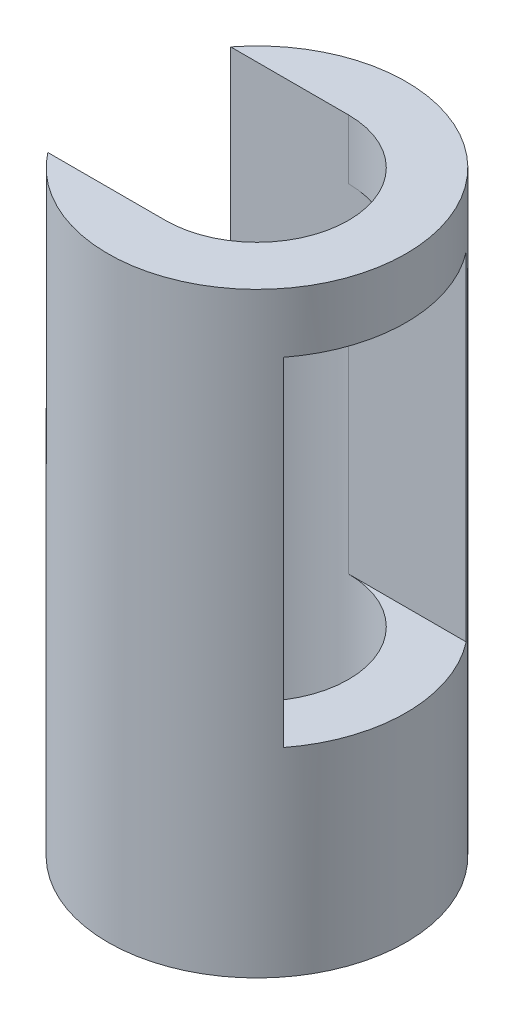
SolidWorks part; units mm, degrees
ref_plane "前视基准面" through (0, 0, 0) normal (0, 0, 1) x (1, 0, 0)
ref_plane "上视基准面" through (0, 0, 0) normal (0, 1, 0) x (1, 0, 0)
ref_plane "右视基准面" through (0, 0, 0) normal (1, 0, 0) x (0, 0, -1)
sketch "草图1" plane through (0, 0, 0) normal (0, 1, 0) x (1, 0, 0)
  circle A0 centre (0, 0) radius 4.6
  circle A1 centre (0, 0) radius 7.5
  dimension "D1" = 9.2
  dimension "D2" = 15
extrude "凸台-拉伸1" add sketch "草图1" along normal blind 10
sketch "草图2" plane through (0, 10, 0) normal (0, 1, 0) x (1, 0, 0)
  line L0 (-5.9237, 4.6) -> (0, 4.6)
  line L1 (0, 4.6) -> (5.9237, 4.6)
  line L2 (-5.9237, -4.6) -> (0, -4.6)
  line L3 (0, -4.6) -> (5.9237, -4.6)
  circle A0 centre (0, 0) radius 7.5 construction
  arc A1 (5.9237, 4.6) -> (-5.9237, 4.6) centre (0, 0) ccw
  circle A2 centre (0, 0) radius 4.6 construction
  arc A3 (-5.9237, -4.6) -> (5.9237, -4.6) centre (0, 0) ccw
extrude "凸台-拉伸2" add sketch "草图2" along normal blind 20
sketch "草图3" plane through (0, 30, 0) normal (0, 1, 0) x (1, 0, 0)
  line L0 (5.9237, -4.6) -> (0, -4.6) construction
  line L1 (-5.9237, 4.6) -> (5.9237, 4.6) construction
  line L2 (5.9237, -4.6) -> (0, -4.6)
  line L3 (0, 4.6) -> (5.9237, 4.6)
  arc A0 (5.9237, -4.6) -> (5.9237, 4.6) centre (0, 0) ccw construction
  arc A1 (0, -4.6) -> (0, 4.6) centre (0, 0) ccw construction
  arc A2 (5.9237, -4.6) -> (5.9237, 4.6) centre (0, 0) ccw
  arc A3 (0, -4.6) -> (0, 4.6) centre (0, 0) ccw
extrude "凸台-拉伸3" add sketch "草图3" against normal blind 3
ref_plane "基准面1" through (0, 0, 7.5) normal (0, 0, 1) x (1, 0, 0)
sketch "草图4" plane through (0, 0, 7.5) normal (0, 0, 1) x (1, 0, 0)
  line L0 (7.5, 30) -> (-5.9237, 30) construction
  line L1 (-2, 22) -> (2, 22) construction
  circle A0 centre (0, 22) radius 2
  dimension "D1" = 4
  dimension "D2" = 8
sketch "草图5" plane through (0, 10, 0) normal (0, 1, 0) x (1, 0, 0)
  line L0 (-5.9237, 4.6) -> (0, 4.6) construction
  line L1 (0, -4.6) -> (-5.9237, -4.6) construction
  line L2 (-5.9237, 4.6) -> (0, 4.6)
  line L3 (0, -4.6) -> (-5.9237, -4.6)
  arc A0 (-5.9237, 4.6) -> (-5.9237, -4.6) centre (0, 0) ccw construction
  arc A1 (0, 4.6) -> (0, -4.6) centre (0, 0) ccw construction
  arc A2 (-5.9237, 4.6) -> (-5.9237, -4.6) centre (0, 0) ccw
  arc A3 (0, 4.6) -> (0, -4.6) centre (0, 0) ccw
extrude "凸台-拉伸4" add sketch "草图5" along normal up to surface (20 mm away)
ref_plane "基准面2" through (0, 22, 0) normal (0, 1, 0) x (1, 0, 0)
sketch "草图6" plane through (0, 22, 0) normal (0, 1, 0) x (1, 0, 0)
  point P0 (0, 0)
sketch "草图7" plane through (0, 0, 0) normal (0, -1, 0) x (1, 0, 0)
  line L0 (0, 7.5) -> (0, -7.5) construction
  circle A0 centre (0, 0) radius 7.5 construction
ref_plane "基准面3" through (0, 0, 0) normal (0.9763, 0.2164, 0) x (0, 0, -1)
ref_plane "基准面4" through (-17.0852, -3.7877, 0) normal (0.9763, 0.2164, 0) x (0, 0, -1)
sketch "草图8" plane through (-17.0852, -3.7877, 0) normal (0.9763, 0.2164, 0) x (0, 0, -1)
  circle A0 centre (0, 21.4785) radius 4.6
  dimension "D1" = 9.2
extrude "切除-拉伸1" cut sketch "草图8" along normal blind 25
sketch "草图9" plane through (0, 30, 0) normal (0, 1, 0) x (1, 0, 0)
  line L2 (0, 4.6) -> (-5.9237, 4.6)
  line L3 (-5.9237, -4.6) -> (0, -4.6)
  line L4 (0, 4.6) -> (-5.9237, 4.6)
  line L5 (-5.9237, -4.6) -> (0, -4.6)
  arc A2 (0, 4.6) -> (0, -4.6) centre (0, 0) ccw
  arc A3 (-5.9237, 4.6) -> (-5.9237, -4.6) centre (0, 0) ccw
  arc A4 (0, 4.6) -> (0, -4.6) centre (0, 0) ccw
  arc A5 (-5.9237, 4.6) -> (-5.9237, -4.6) centre (0, 0) ccw
  dimension "D1" = 0
extrude "切除-拉伸2" cut sketch "草图9" against normal blind 9
